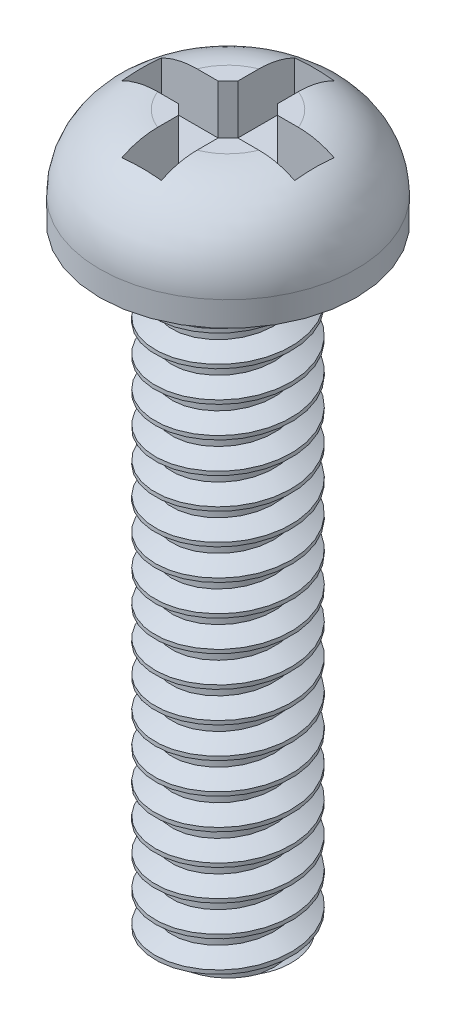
SolidWorks part; units mm, degrees
ref_plane "Front Plane" through (0, 0, 0) normal (0, 0, 1) x (1, 0, 0)
ref_plane "Top Plane" through (0, 0, 0) normal (0, 1, 0) x (1, 0, 0)
ref_plane "Right Plane" through (0, 0, 0) normal (1, 0, 0) x (0, 0, -1)
sketch "Sketch1" plane through (0, 0, 0) normal (0, 1, 0) x (1, 0, 0)
  circle A0 centre (0, 0) radius 1.7526
extrude "Boss-Extrude1" add sketch "Sketch1" along normal blind 15.875
sketch "Sketch2" plane through (0, 15.875, 0) normal (0, 1, 0) x (1, 0, 0)
  circle A0 centre (0, 0) radius 3.302
extrude "Boss-Extrude2" add sketch "Sketch2" along normal blind 2.54
sketch "Sketch3" plane through (0, 18.415, 0) normal (0, 1, 0) x (1, 0, 0)
  line L0 (0.762, 0.508) -> (2.2225, 0.508)
  line L1 (-0.508, -2.2225) -> (0.508, -2.2225)
  line L2 (-0.508, -2.2225) -> (-0.508, -0.762)
  line L3 (-0.508, 2.2225) -> (0.508, 2.2225)
  line L4 (0.508, -2.2225) -> (0.508, -0.762)
  line L5 (-0.508, 0.762) -> (-0.508, 2.2225)
  line L6 (0.762, -0.508) -> (2.2225, -0.508)
  line L7 (-2.2225, 0.508) -> (-0.762, 0.508)
  line L8 (-2.2225, 0.508) -> (-2.2225, -0.508)
  line L9 (-2.2225, -0.508) -> (-0.762, -0.508)
  line L10 (2.2225, 0.508) -> (2.2225, -0.508)
  line L11 (0.508, 0.762) -> (0.508, 2.2225)
  line L12 (-0.762, 0.508) -> (-0.508, 0.762)
  line L13 (0.508, 0.762) -> (0.762, 0.508)
  line L14 (0.508, -0.762) -> (0.762, -0.508)
  line L15 (-0.508, -0.762) -> (-0.762, -0.508)
  point P0 (-0.508, 0.508)
  point P5 (0.508, -0.508)
  point P6 (0, 0)
  point P13 (0.508, 0.508)
  point P14 (-0.508, -0.508)
extrude "Cut-Extrude1" cut sketch "Sketch3" against normal blind 1.27
fillet "Fillet1" radius 1.905 1 edges at (0, 18.415, 3.302)
thread "Thread1" pitch 0.7937 start angle 0, offset 1, length 16.002, pitch 0.7937, diameter 3.5052
ref_plane "Plane1" through (1.7526, -1, 0) normal (0, 0, 1) x (1, 0, 0)
sketch "Thread Profile1" plane through (1.7526, -1, 0) normal (0, 0, 1) x (1, 0, 0)
  line L0 (0, 0) -> (0, 0.7937) construction
  line L11 (0, 0) -> (0, 0.6945)
  line L12 (0, 0.6945) -> (-0.4296, 0.4465)
  line L13 (-0.4296, 0.4465) -> (-0.4296, 0.248)
  line L15 (-0.4296, 0.248) -> (0, 0)
  line L17 (-0.4296, 0.3473) -> (0, 0.3473) construction
  point P2 (0, 0)
  dimension "Pitch" = 0.7937
  dimension "Profile_Angle" = 60
  dimension "Profile_Land" = 0.1984
  dimension "Profile_Height" = 0.4296
